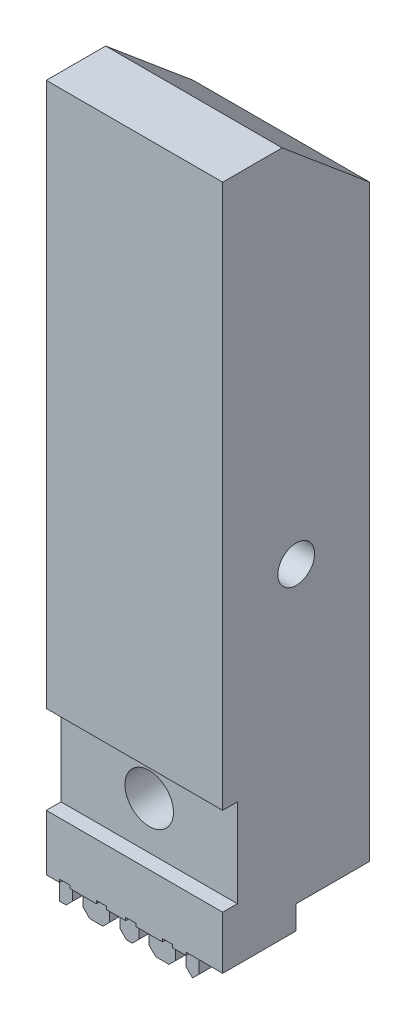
SolidWorks part; units mm, degrees
ref_plane "前视基准面" through (0, 0, 0) normal (0, 0, 1) x (1, 0, 0)
ref_plane "上视基准面" through (0, 0, 0) normal (0, 1, 0) x (1, 0, 0)
ref_plane "右视基准面" through (0, 0, 0) normal (1, 0, 0) x (0, 0, -1)
sketch "草图1" plane through (0, 0, 0) normal (0, 0, 1) x (1, 0, 0)
  line L0 (0, 0) -> (0, 49)
  line L1 (12, 2.2) -> (12, 49)
  line L2 (0.9, 2.2) -> (1.6, 2.2)
  line L3 (0, 49) -> (12, 49)
  line L4 (0, 0) -> (0.45, 0)
  line L5 (1.6, 2.2) -> (1.6, 0.45)
  line L6 (3.4, 2.2) -> (3.4, 0.45)
  line L7 (6.1, 2.2) -> (6.1, 0.45)
  line L8 (7.9, 2.2) -> (7.9, 0.45)
  line L9 (4.1, 2.2) -> (4.1, 0.45)
  line L10 (5.4, 2.2) -> (5.4, 0.45)
  line L11 (8.6, 2.2) -> (8.6, 0.45)
  line L12 (9.5, 2.2) -> (9.5, 0.45)
  line L13 (0.9, 2.2) -> (0.9, 0.45)
  line L14 (2.05, 0) -> (2.95, 0)
  line L15 (4.55, 0) -> (4.95, 0)
  line L16 (6.55, 0) -> (7.45, 0)
  line L17 (0.45, 0) -> (0.9, 0.45)
  line L18 (2.05, 0) -> (1.6, 0.45)
  line L19 (2.95, 0) -> (3.4, 0.45)
  line L20 (4.55, 0) -> (4.1, 0.45)
  line L21 (4.95, 0) -> (5.4, 0.45)
  line L22 (6.55, 0) -> (6.1, 0.45)
  line L23 (7.45, 0) -> (7.9, 0.45)
  line L24 (9.05, 0) -> (8.6, 0.45)
  line L25 (9.5, 0.45) -> (9.05, 0)
  line L26 (3.4, 2.2) -> (4.1, 2.2)
  line L27 (5.4, 2.2) -> (6.1, 2.2)
  line L28 (7.9, 2.2) -> (8.6, 2.2)
  line L29 (9.5, 2.2) -> (12, 2.2)
extrude "凸台-拉伸1" add sketch "草图1" along normal blind 10
sketch "草图2" plane through (0, 0, 10) normal (0, 0, 1) x (1, 0, 0)
  circle A0 centre (6, 9) radius 1.65
extrude "切除-拉伸1" cut sketch "草图2" against normal through all
sketch "草图3" plane through (12, 0, 0) normal (1, 0, 0) x (0, 0, -1)
  line L0 (-10, 2) -> (-9.1, 2)
  line L1 (0, 3.8) -> (0, 43.8)
  line L2 (-5, 3.8) -> (0, 3.8)
  line L3 (-10, 48.8) -> (-5.9588, 48.8)
  line L4 (-5, 2) -> (-5, 3.8)
  line L5 (-10, 2) -> (-10, 5.8)
  line L6 (-9.1, 0) -> (-9.1, 2)
  line L7 (-8.3, 0) -> (-8.3, 2)
  line L8 (-9.1, 0) -> (-8.3, 0)
  line L9 (-10, 5.8) -> (-9, 5.8)
  line L10 (-9, 11.8) -> (-10, 11.8)
  line L11 (-9, 5.8) -> (-9, 11.8)
  line L12 (-10, 11.8) -> (-10, 48.8)
  line L13 (-5.9588, 48.8) -> (0, 43.8)
  line L14 (-8.3, 2) -> (-5, 2)
extrude "切除-拉伸2" cut sketch "草图3" against normal through all flip side to cut
sketch "草图4" plane through (12, 0, 0) normal (1, 0, 0) x (0, 0, -1)
  circle A0 centre (-5, 23.8) radius 1.25
extrude "切除-拉伸3" cut sketch "草图4" against normal through all
